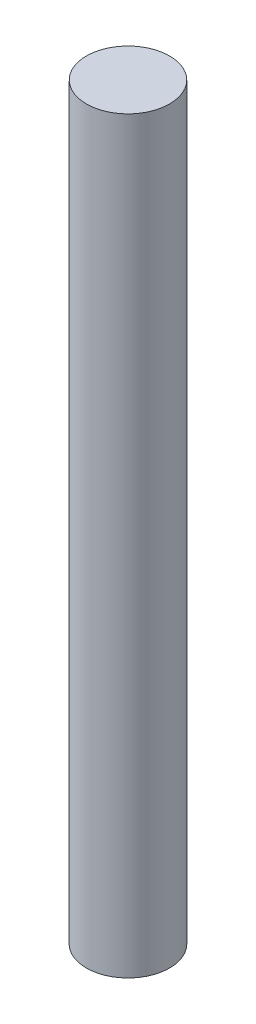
SolidWorks part; units mm, degrees
ref_plane "Plan de face" through (0, 0, 0) normal (0, 0, 1) x (1, 0, 0)
ref_plane "Plan de dessus" through (0, 0, 0) normal (0, 1, 0) x (1, 0, 0)
ref_plane "Plan de droite" through (0, 0, 0) normal (1, 0, 0) x (0, 0, -1)
sketch "Esquisse1" plane through (0, 0, 0) normal (0, 1, 0) x (1, 0, 0)
  circle A0 centre (0, 0) radius 0.25
  dimension "D1" = 0.5
extrude "Extrusion1" add sketch "Esquisse1" along normal blind 4.5
